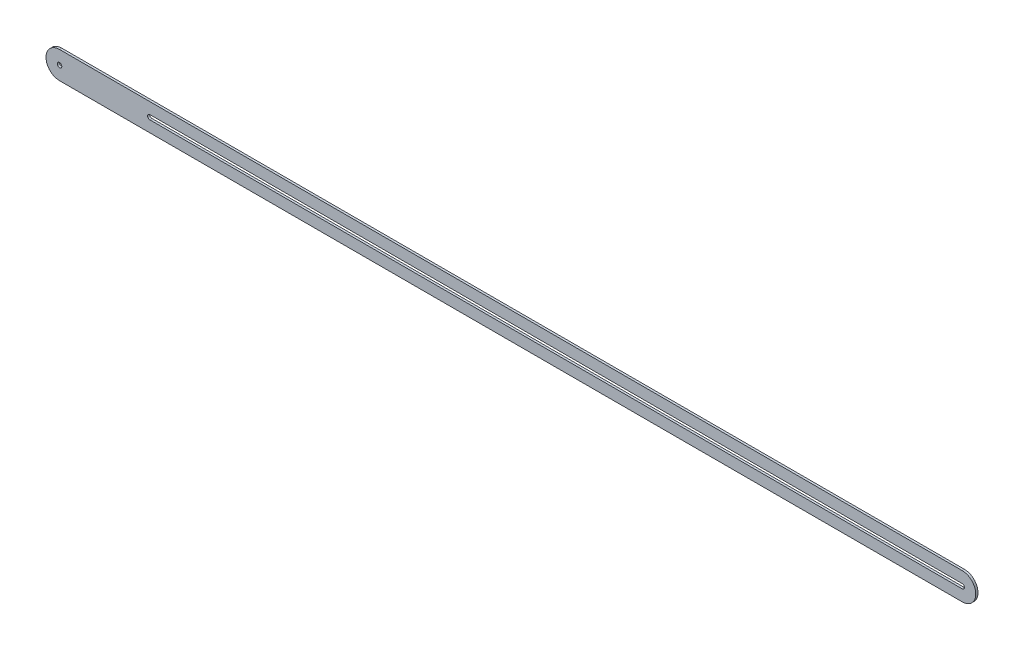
SolidWorks part; units mm, degrees
ref_plane "Front Plane" through (0, 0, 0) normal (0, 0, 1) x (1, 0, 0)
ref_plane "Top Plane" through (0, 0, 0) normal (0, 1, 0) x (1, 0, 0)
ref_plane "Right Plane" through (0, 0, 0) normal (1, 0, 0) x (0, 0, -1)
sketch "Sketch1" plane through (0, 0, 0) normal (0, 0, 1) x (1, 0, 0)
  line L0 (0, 0) -> (400, 0) construction
  line L1 (0.55, 0) -> (-0.55, 0) construction
  line L2 (0, 6) -> (400, 6)
  line L3 (0, -6) -> (400, -6)
  line L4 (40, 0) -> (400, 0) construction
  line L5 (40, 1) -> (400, 1)
  line L6 (40, -1) -> (400, -1)
  arc A0 (0, 6) -> (0, -6) centre (0, 0) ccw
  arc A1 (400, -6) -> (400, 6) centre (400, 0) ccw
  circle A2 centre (0, 0) radius 1
  arc A4 (40, 1) -> (40, -1) centre (40, 0) ccw
  arc A5 (400, -1) -> (400, 1) centre (400, 0) ccw
  point P5 (200, 0)
  point P16 (220, 0)
  dimension "D2" = 6
  dimension "D3" = 2
  dimension "D4" = 1
  dimension "D1" = 400
  dimension "D5" = 40
extrude "Boss-Extrude1" add sketch "Sketch1" along normal blind 1
